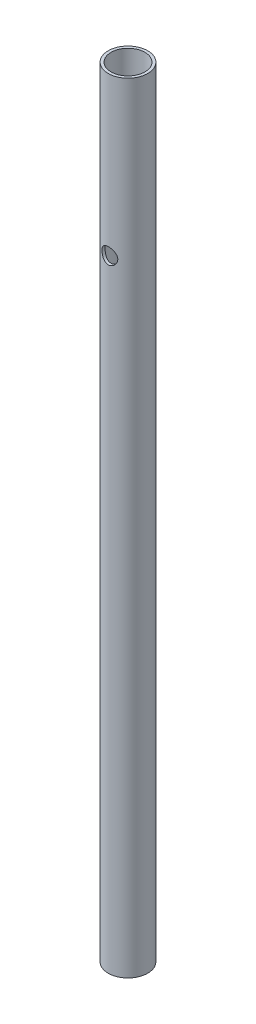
SolidWorks part; units mm, degrees
ref_plane "Front Plane" through (0, 0, 0) normal (0, 0, 1) x (1, 0, 0)
ref_plane "Top Plane" through (0, 0, 0) normal (0, 1, 0) x (1, 0, 0)
ref_plane "Right Plane" through (0, 0, 0) normal (1, 0, 0) x (0, 0, -1)
sketch "Sketch1" plane through (0, 0, 0) normal (0, 1, 0) x (1, 0, 0)
  circle A0 centre (0, 0) radius 6.35
  circle A1 centre (0, 0) radius 5.461
  dimension "D1" = 12.7
  dimension "D2" = 10.922
extrude "Boss-Extrude1" add sketch "Sketch1" along normal blind 250.825
sketch "Sketch2" plane through (0, 0, 0) normal (0, 0, 1) x (1, 0, 0)
  line L0 (6.35, 250.825) -> (-6.35, 250.825) construction
  circle A0 centre (0, 200.025) radius 2.54
  dimension "D2" = 5.08
  dimension "D1" = 50.8
extrude "Cut-Extrude1" cut sketch "Sketch2" against normal through all and the other way through all
